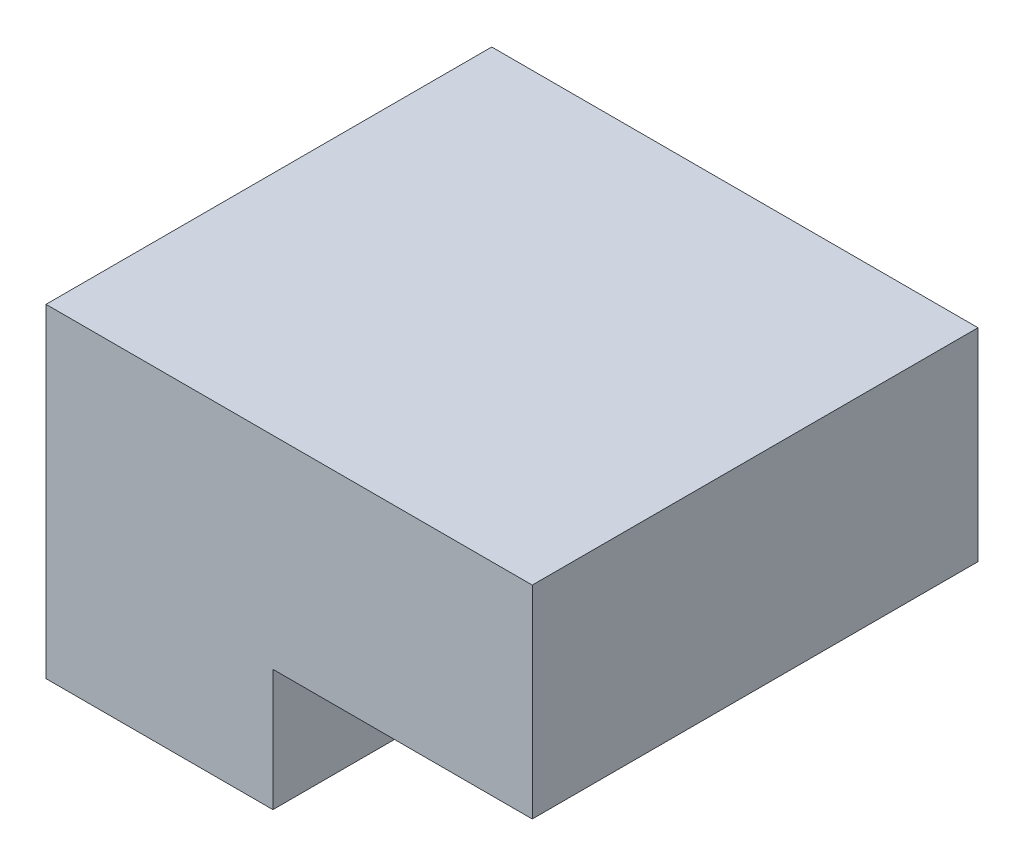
SolidWorks part; units mm, degrees
ref_plane "前视基准面" through (0, 0, 0) normal (0, 0, 1) x (1, 0, 0)
ref_plane "上视基准面" through (0, 0, 0) normal (0, 1, 0) x (1, 0, 0)
ref_plane "右视基准面" through (0, 0, 0) normal (1, 0, 0) x (0, 0, -1)
sketch "草图1" plane through (0, 0, 0) normal (0, 0, 1) x (1, 0, 0)
  line L1 (0, 0) -> (-60, 0)
  line L2 (0, 0) -> (0, 40)
  line L3 (0, 40) -> (-60, 40)
  line L4 (-60, 0) -> (-60, 40)
  dimension "D1" = 60
  dimension "D2" = 40
extrude "拉伸1" add sketch "草图1" along normal blind 55
sketch "草图2" plane through (0, 0, 0) normal (0, -1, 0) x (1, 0, 0)
  line L0 (-32, 55) -> (0, 55)
  line L3 (-60, 33) -> (-32, 33)
  line L4 (-32, 55) -> (-32, 33)
  line L5 (0, 55) -> (0, 0)
  line L6 (0, 0) -> (-60, 0)
  line L7 (-60, 0) -> (-60, 33)
  dimension "D1" = 22
  dimension "D2" = 28
extrude "切除-拉伸1" cut sketch "草图2" against normal blind 15
